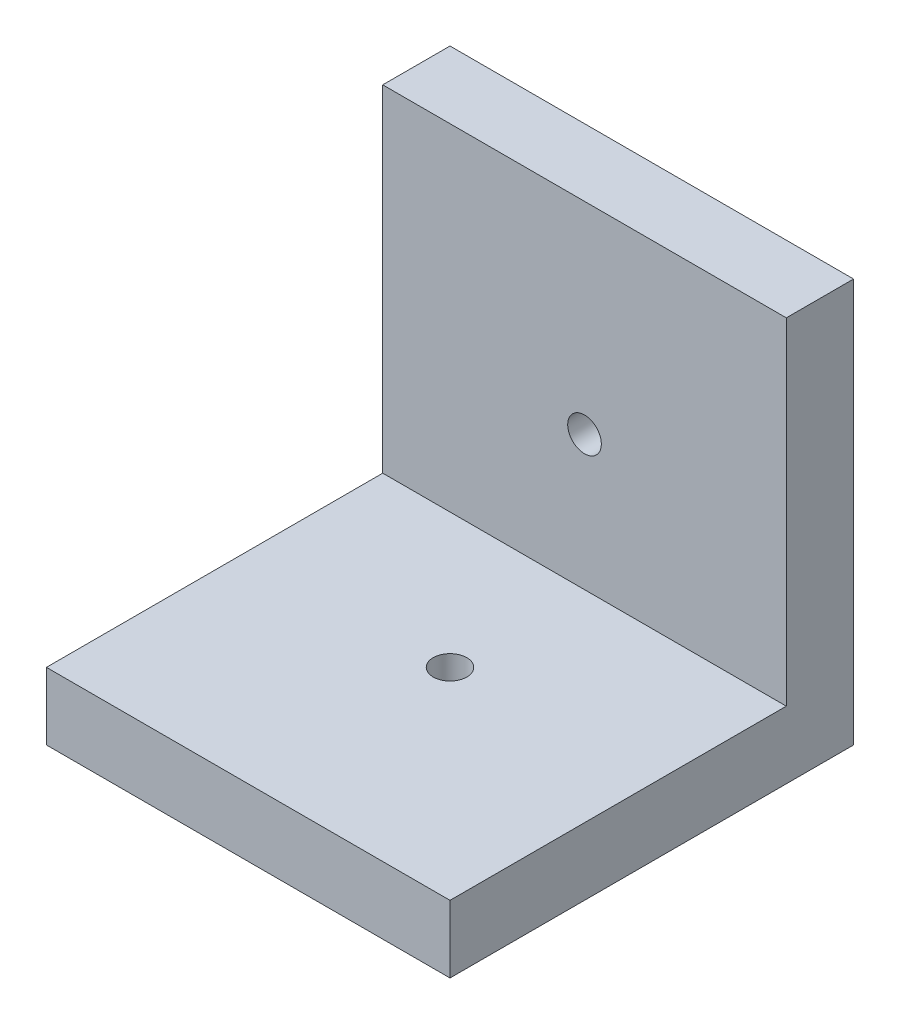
SolidWorks part; units mm, degrees
ref_plane "Front" through (0, 0, 0) normal (0, 0, 1) x (1, 0, 0)
ref_plane "Top" through (0, 0, 0) normal (0, 1, 0) x (1, 0, 0)
ref_plane "Right" through (0, 0, 0) normal (1, 0, 0) x (0, 0, -1)
sketch "스케치1" plane through (0, 0, 0) normal (0, 0, 1) x (1, 0, 0)
  line L1 (19.05, -19.05) -> (-19.05, -19.05)
  line L2 (19.05, -19.05) -> (19.05, 19.05)
  line L3 (19.05, 19.05) -> (-19.05, 19.05)
  line L4 (-19.05, -19.05) -> (-19.05, 19.05)
  line L5 (0, 19.05) -> (0, -19.05) construction
  line L6 (19.05, 0) -> (-19.05, 0) construction
  circle A0 centre (0, 0) radius 1.5875
  point P1 (0, 0)
  dimension "D1" = 38.1
  dimension "D3" = 3.175
  dimension "D2" = 38.1
extrude "보스-돌출1" add sketch "스케치1" along normal blind 6.35
sketch "스케치2" plane through (0, 0, 6.35) normal (0, 0, 1) x (1, 0, 0)
  line L0 (-19.05, 19.05) -> (-19.05, -19.05) construction
  line L1 (-19.05, -12.7) -> (19.05, -12.7)
  line L2 (-19.05, -12.7) -> (-19.05, -19.05)
  line L3 (-19.05, -19.05) -> (19.05, -19.05)
  line L4 (19.05, -12.7) -> (19.05, -19.05)
  dimension "D1" = 6.35
extrude "보스-돌출2" add sketch "스케치2" along normal blind 31.75
sketch "스케치3" plane through (0, -19.05, 0) normal (0, -1, 0) x (1, 0, 0)
  line L0 (-19.05, 38.1) -> (19.05, 38.1) construction
  line L2 (-19.05, 38.1) -> (-19.05, 0) construction
  circle A0 centre (0, 19.05) radius 1.5875
  point P6 (-19.05, 32.0581)
  dimension "D1" = 19.05
  dimension "D3" = 3.175
  dimension "D2" = 19.05
extrude "컷-돌출1" cut sketch "스케치3" against normal blind 31.75
